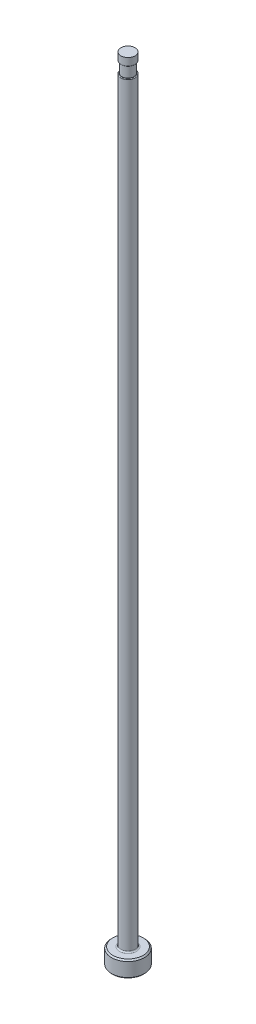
SolidWorks part; units mm, degrees
ref_plane "Front Plane" through (0, 0, 0) normal (0, 0, 1) x (1, 0, 0)
ref_plane "Top Plane" through (0, 0, 0) normal (0, 1, 0) x (1, 0, 0)
ref_plane "Right Plane" through (0, 0, 0) normal (1, 0, 0) x (0, 0, -1)
other "Configuration Table"
sketch "Sketch1" plane through (0, 0, 0) normal (0, 0, 1) x (1, 0, 0)
  line L0 (0, 259.9588) -> (0, -15.1925) construction
  line L1 (0, 0) -> (-3.175, 0)
  line L2 (-3.175, 0) -> (-3.175, 3.175)
  line L3 (-3.175, 3.175) -> (-1.3881, 3.175)
  line L4 (-1.3881, 3.175) -> (-1.3881, 152.4)
  line L5 (-1.3881, 152.4) -> (0, 152.4)
  line L6 (0, 152.4) -> (0, 0)
  dimension "L" = 152.4
  dimension "H" = 6.35
  dimension "T" = 3.175
  dimension "D" = 2.7762
revolve "Revolve1" add sketch "Sketch1" angle 360 about L0
chamfer "Chamfer1" distance 0.254 angle 45 2 edges at (0, 3.175, 3.175) (0, 0, 3.175)
fillet "Fillet1" radius 0.254 1 edges at (0, 3.175, 1.3881)
sketch "Sketch2" plane through (0, 0, 0) normal (0, 0, 1) x (1, 0, 0)
  line L0 (-1.3881, 152.4) -> (-1.3881, 3.429) construction
  line L1 (-1.3881, 150.876) -> (-1.1849, 150.876)
  line L2 (-1.3881, 150.876) -> (-1.3881, 148.844)
  line L3 (-1.3881, 148.844) -> (-1.1849, 148.844)
  line L4 (-1.1849, 150.876) -> (-1.1849, 148.844)
  line L5 (1.3881, 152.4) -> (-1.3881, 152.4) construction
  line L6 (0, 153.4483) -> (0, 147.3282) construction
  dimension "D1" = 2.032
  dimension "N" = 1.524
  dimension "FD" = 0.2032
  dimension "D3" = 2.3698
revolve "Vent Relief" cut sketch "Sketch2" angle 360 about L6
sketch "Sketch3" plane through (0, 0, 0) normal (0, 0, 1) x (1, 0, 0)
  line L0 (-1.1849, 149.86) -> (-1.1849, 86.36)
  line L1 (-1.1849, 150.876) -> (-1.1849, 148.844) construction
  line L2 (-1.3881, 148.844) -> (-1.3881, 3.429) construction
  line L3 (-1.3881, 85.2424) -> (-1.3881, 149.86)
  line L4 (-1.3881, 149.86) -> (-1.1849, 149.86)
  arc A0 (-1.1849, 86.36) -> (-1.3881, 85.2424) centre (-4.3599, 86.36) cw
  dimension "D1" = 3.175
  dimension "D2" = 63.5
extrude "D-Slot" cut sketch "Sketch3" against normal through all both and the other way through all
sketch "Sketch5" plane through (0, 0, 0) normal (0, 0, 1) x (1, 0, 0)
  line L0 (-1.3881, 150.876) -> (1.3881, 150.876) construction
  line L1 (-1.3881, 152.4) -> (-1.3627, 152.4)
  line L2 (-1.3881, 152.4) -> (-1.3881, 150.876)
  line L3 (-1.3881, 150.876) -> (-1.3627, 150.876)
  line L4 (-1.3627, 152.4) -> (-1.3627, 150.876)
  line L5 (0, 152.6877) -> (0, 150.5771) construction
  dimension "VP" = 0.0254
revolve "Vent Diameter" cut sketch "Sketch5" angle 360 about L5
fillet "Fillet2" radius 0.127 2 edges at (1.3881, 148.844, 0) (0, 150.876, 1.3627)
sketch "Pocket Sketch" plane through (0, 0, 0) normal (0, 0, 1) x (1, 0, 0)
  line L0 (-3.5719, 0) -> (-3.5719, 3.2004)
  line L1 (-3.5719, 3.2004) -> (-2.3485, 3.2004)
  line L2 (-1.5865, 3.9624) -> (-1.5865, 22.225)
  line L3 (-1.5865, 22.225) -> (0, 22.225)
  line L4 (0, 22.225) -> (0, 0)
  line L5 (0, 0) -> (-3.5719, 0)
  line L6 (0, 12.6104) -> (0, -2.4989) construction
  line L7 (-3.175, 2.921) -> (-3.175, 0.254) construction
  line L8 (2.921, 3.175) -> (-2.921, 3.175) construction
  line L9 (-1.3881, 85.2424) -> (-1.3881, 3.429) construction
  line L10 (-2.3485, 3.2004) -> (-1.5865, 3.9624)
  point P3 (-1.5865, 3.2004)
  dimension "D1" = 7.1437
  dimension "D2" = 0.3969
  dimension "D3" = 0.0254
  dimension "D4" = 0.1984
  dimension "D5" = 3.1731
  dimension "D6" = 22.225
